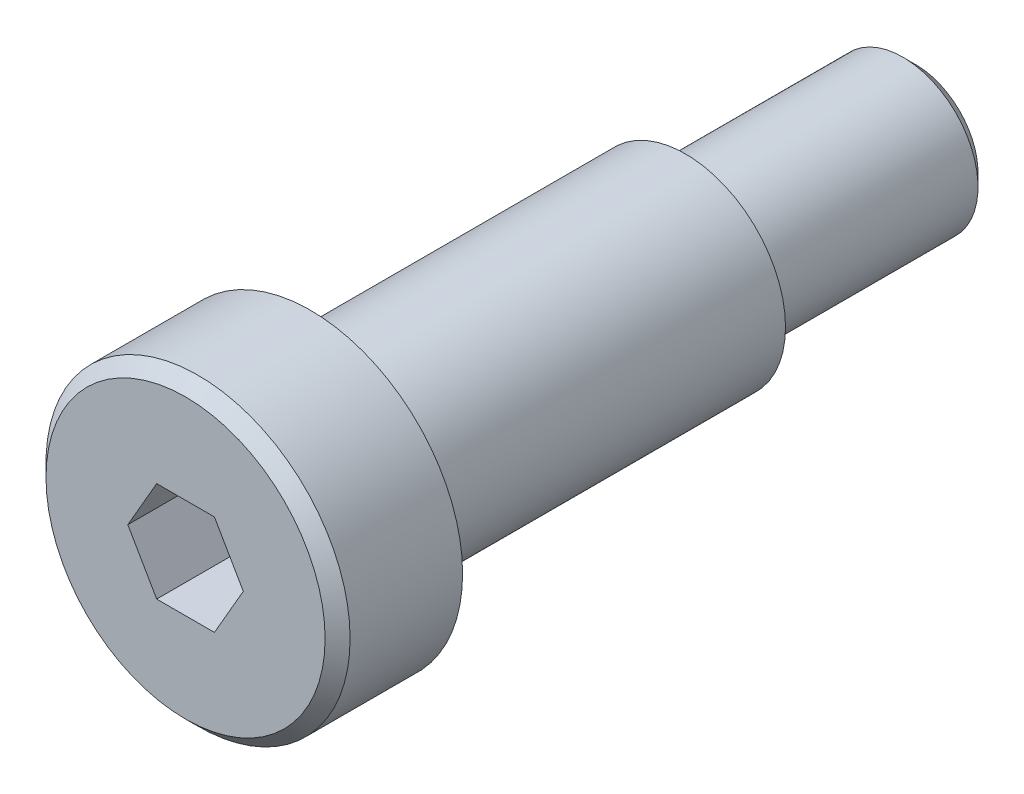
SolidWorks part; units mm, degrees
ref_plane "Front" through (0, 0, 0) normal (0, 0, 1) x (1, 0, 0)
ref_plane "Top" through (0, 0, 0) normal (0, 1, 0) x (1, 0, 0)
ref_plane "Right" through (0, 0, 0) normal (1, 0, 0) x (0, 0, -1)
sketch "Esquisse1" plane through (0, 0, 0) normal (0, 0, 1) x (1, 0, 0)
  circle A0 centre (0, 0) radius 12.165
  dimension "D1" = 24.33
extrude "Boss.-Extru.1" add sketch "Esquisse1" along normal blind 10
sketch "Esquisse2" plane through (0, 0, 0) normal (0, 0, -1) x (-1, 0, 0)
  circle A0 centre (0, 0) radius 8
  dimension "D1" = 16
extrude "Boss.-Extru.2" add sketch "Esquisse2" along normal blind 30
sketch "Esquisse3" plane through (0, 0, -30) normal (0, 0, -1) x (-1, 0, 0)
  circle A0 centre (0, 0) radius 6
  dimension "D1" = 12
extrude "Boss.-Extru.3" add sketch "Esquisse3" along normal blind 18.4
chamfer "Chanfrein1" distance 1 angle 45 2 edges at (12.165, 0, 10) (-6, 0, -48.4)
sketch "Esquisse4" plane through (0, 0, 10) normal (0, 0, 1) x (1, 0, 0)
  line L0 (0, 0) -> (4.6188, 0) construction
  line L1 (4.6188, 0) -> (2.3094, 4)
  line L2 (2.3094, 4) -> (-2.3094, 4)
  line L3 (-2.3094, 4) -> (-4.6188, 0)
  line L4 (-4.6188, 0) -> (-2.3094, -4)
  line L5 (-2.3094, -4) -> (2.3094, -4)
  line L6 (2.3094, -4) -> (4.6188, 0)
  circle A0 centre (0, 0) radius 4 construction
  dimension "D1" = 8
extrude "Enlèv. mat.-Extru.1" cut sketch "Esquisse4" against normal blind 6.6
